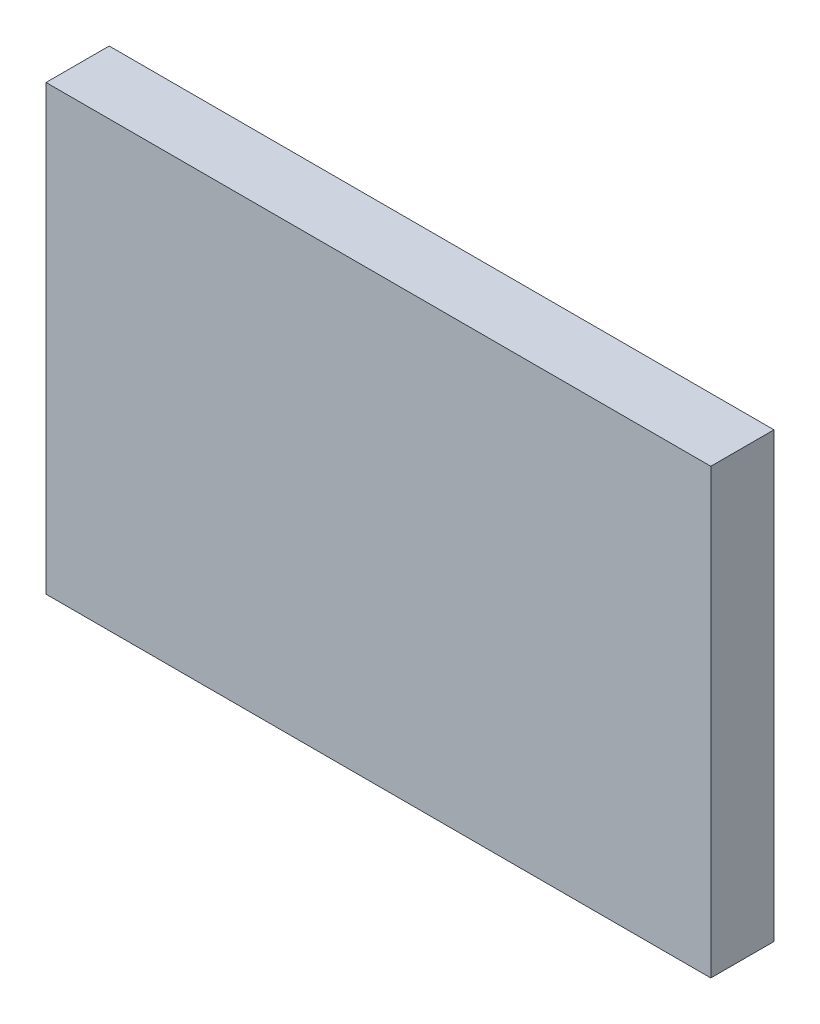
SolidWorks part; units mm, degrees
ref_plane "Piano frontale" through (0, 0, 0) normal (0, 0, 1) x (1, 0, 0)
ref_plane "Piano superiore" through (0, 0, 0) normal (0, 1, 0) x (1, 0, 0)
ref_plane "Piano destro" through (0, 0, 0) normal (1, 0, 0) x (0, 0, -1)
sketch "Sketch3" plane through (0, 0, 0) normal (0, 0, 1) x (1, 0, 0)
  line L1 (21.6975, 12.7076) -> (81.6975, 12.7076)
  line L2 (21.6975, 12.7076) -> (21.6975, -27.2924)
  line L3 (21.6975, -27.2924) -> (81.6975, -27.2924)
  line L4 (81.6975, 12.7076) -> (81.6975, -27.2924)
  dimension "D1" = 40
  dimension "D2" = 60
extrude "Boss-Extrude1" add sketch "Sketch3" along normal blind 5.7
equation "\"r\"= 15mm"
equation "\"h\"= 5.7mm"
equation "\"l\"= 60mm"
equation "\"lh\"= 40mm"
equation "\"D1\"= \"r\" / 2"
equation "\"D2\"= \"h\""
equation "\"D3\"= \"r\" / 2"
equation "\"D1@Boss-Extrude1\"=\"h\""
